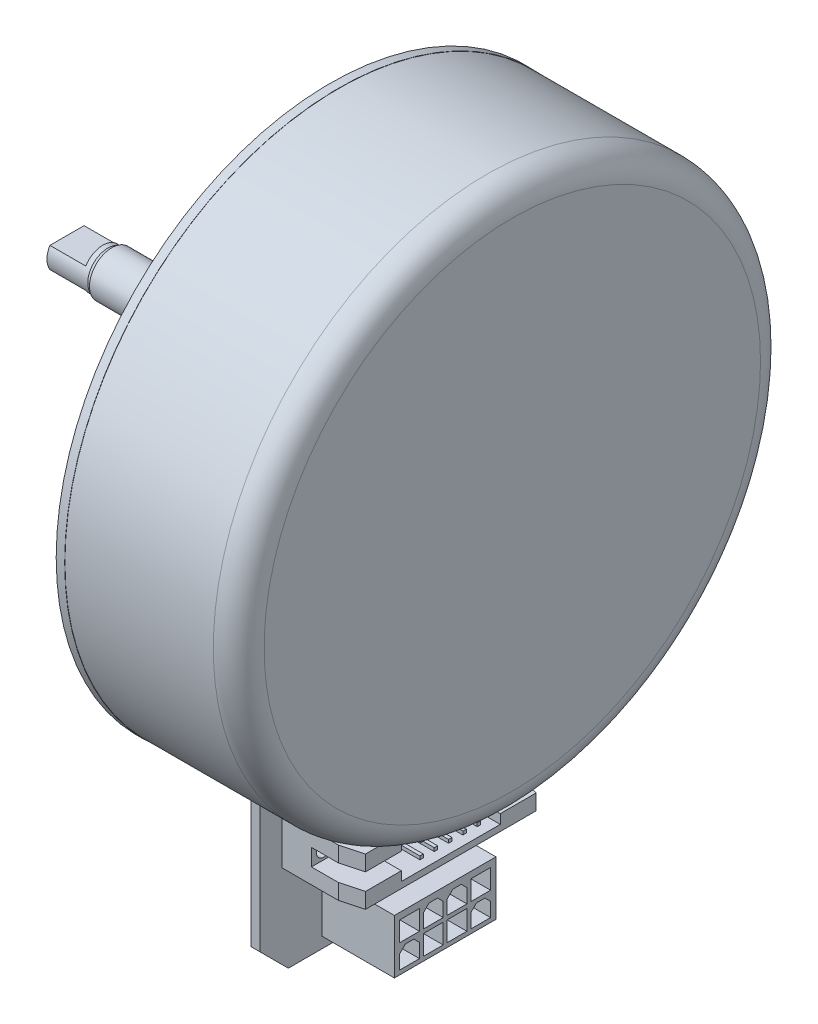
SolidWorks part; units mm, degrees
ref_plane "Front Plane" through (0, 0, 0) normal (0, 0, 1) x (1, 0, 0)
ref_plane "Top Plane" through (0, 0, 0) normal (0, 1, 0) x (1, 0, 0)
ref_plane "Right Plane" through (0, 0, 0) normal (1, 0, 0) x (0, 0, -1)
ref_plane "Plane1" through (7.6, 0, 0) normal (1, 0, 0) x (0, 0, -1)
sketch "Sketch1" plane through (7.6, 0, 0) normal (1, 0, 0) x (0, 0, -1)
  line L0 (-20, -44.1843) -> (20, -44.1843)
  arc A0 (20, -44.1843) -> (-20, -44.1843) centre (0, 0) ccw
extrude "Boss-Extrude1" add sketch "Sketch1" against normal blind 1.6
sketch "Sketch2" plane through (0, -44.1843, 0) normal (0, -1, 0) x (1, 0, 0)
  line L0 (7.6, 20) -> (7.6, -20)
  line L1 (7.6, -20) -> (6, -20)
  line L2 (6, -20) -> (6, 20)
  line L3 (6, 20) -> (7.6, 20)
extrude "Boss-Extrude2" add sketch "Sketch2" along normal blind 31.3157
sketch "Sketch3" plane through (7.6, 0, 0) normal (1, 0, 0) x (0, 0, -1)
  line L0 (-20, -51.5) -> (20, -51.5)
  line L1 (20, -51.5) -> (20, -75.5)
  line L2 (20, -75.5) -> (-20, -75.5)
  line L3 (-20, -75.5) -> (-20, -51.5)
extrude "Boss-Extrude3" add sketch "Sketch3" along normal blind 12.8
ref_plane "Plane2" through (0, 0, -1.7) normal (0, 0, -1) x (-1, 0, 0)
sketch "Sketch4" plane through (0, 0, -1.7) normal (0, 0, -1) x (-1, 0, 0)
  line L0 (-18.4, -75.5) -> (-20.4, -74.1)
  line L1 (-20.4, -74.1) -> (-20.4, -75.5)
  line L2 (-20.4, -75.5) -> (-18.4, -75.5)
extrude "Cut-Extrude1" cut sketch "Sketch4" against normal blind 3.4
sketch "Sketch5" plane through (0, -75.5, 0) normal (0, -1, 0) x (1, 0, 0)
  line L0 (20.4, 1.7) -> (20.4, 20)
  line L1 (20.4, 20) -> (6, 20)
  line L2 (6, 20) -> (6, -20)
  line L3 (6, -20) -> (20.4, -20)
  line L4 (20.4, -20) -> (20.4, -1.7)
  line L5 (20.4, -1.7) -> (17.4, -1.7)
  line L6 (17.4, -1.7) -> (17.4, 1.7)
  line L7 (17.4, 1.7) -> (20.4, 1.7)
extrude "Cut-Extrude2" cut sketch "Sketch5" against normal blind 1.4
sketch "Sketch6" plane through (20.4, 0, 0) normal (1, 0, 0) x (0, 0, -1)
  line L0 (-20, -51.5) -> (20, -51.5)
  line L1 (20, -51.5) -> (20, -74.1)
  line L2 (20, -74.1) -> (-20, -74.1)
  line L3 (-20, -74.1) -> (-20, -51.5)
extrude "Boss-Extrude4" add sketch "Sketch6" along normal blind 1
sketch "Sketch7" plane through (7.6, 0, 0) normal (1, 0, 0) x (0, 0, -1)
  circle A0 centre (0, 0) radius 48.5
extrude "Boss-Extrude5" add sketch "Sketch7" along normal blind 24.7
sketch "Sketch8" plane through (6, 0, 0) normal (-1, 0, 0) x (0, 0, 1)
  line L0 (-20.1, -42.4852) -> (-20.1, -44.1389)
  line L1 (20.1, -44.1389) -> (20.1, -42.4852)
  arc A0 (20.1, -42.4852) -> (-20.1, -42.4852) centre (0, 0) cw
  arc A1 (-20.1, -44.1389) -> (20.1, -44.1389) centre (0, 0) cw
extrude "Boss-Extrude6" add sketch "Sketch8" along normal blind 4.5
sketch "Sketch9" plane through (6, 0, 0) normal (-1, 0, 0) x (0, 0, 1)
  line L0 (-20, -44.1843) -> (-20, -42.5323)
  line L1 (-20.1, -42.4852) -> (-20.1, -44.1389)
  arc A0 (-20.1, -44.1389) -> (-20, -44.1843) centre (0, 0) ccw
  arc A1 (-20, -42.5323) -> (-20.1, -42.4852) centre (0, 0) cw
extrude "Cut-Extrude3" cut sketch "Sketch9" against normal blind 1.6
sketch "Sketch10" plane through (6, 0, 0) normal (-1, 0, 0) x (0, 0, 1)
  line L0 (20, -42.5323) -> (20, -44.1843)
  line L1 (20.1, -44.1389) -> (20.1, -42.4852)
  arc A0 (20, -44.1843) -> (20.1, -44.1389) centre (0, 0) ccw
  arc A1 (20.1, -42.4852) -> (20, -42.5323) centre (0, 0) cw
extrude "Cut-Extrude4" cut sketch "Sketch10" against normal blind 1.6
sketch "Sketch11" plane through (7.6, 0, 0) normal (-1, 0, 0) x (0, 0, 1)
  line L0 (20.1, -44.1389) -> (20.1, -42.4852)
  line L1 (-20.1, -42.4852) -> (-20.1, -44.1389)
  arc A0 (20.1, -42.4852) -> (-20.1, -42.4852) centre (0, 0) cw
  arc A1 (-20.1, -44.1389) -> (20.1, -44.1389) centre (0, 0) ccw
extrude "Cut-Extrude5" cut sketch "Sketch11" against normal blind 0.7
sketch "Sketch12" plane through (0, -51.5, 0) normal (0, 1, 0) x (-1, 0, 0)
  line L0 (-7.6, 3.135) -> (-7.6, 4.485)
  line L1 (-7.6, 4.485) -> (-16.525, 4.485)
  line L2 (-16.525, 3.135) -> (-7.6, 3.135)
  arc A0 (-16.525, 4.485) -> (-16.525, 3.135) centre (-16.525, 3.81) ccw
extrude "Cut-Extrude6" cut sketch "Sketch12" against normal blind 1.1
ref_plane "Plane3" through (0, -52.6, 0) normal (0, 1, 0) x (1, 0, 0)
sketch "Sketch13" plane through (0, -52.6, 0) normal (0, 1, 0) x (1, 0, 0)
  line L0 (15, 8.765) -> (15, -4.485)
  line L1 (15, -4.485) -> (21.4, -4.485)
  line L2 (21.4, -4.485) -> (21.4, 8.765)
  line L3 (21.4, 8.765) -> (15, 8.765)
extrude "Cut-Extrude7" cut sketch "Sketch13" against normal blind 0.9
sketch "Sketch14" plane through (0, 0, 4.485) normal (0, 0, -1) x (-1, 0, 0)
  line L0 (-21.4, -52.6) -> (-21.4, -53.5)
  line L1 (-21.4, -53.5) -> (-15, -53.5)
  line L2 (-15, -53.5) -> (-15, -52.6)
  line L3 (-15, -52.6) -> (-21.4, -52.6)
extrude "Cut-Extrude8" cut sketch "Sketch14" against normal blind 4.28
sketch "Sketch15" plane through (0, 0, 4.485) normal (0, 0, -1) x (-1, 0, 0)
  line L0 (-12.6, -51.5) -> (-12.6, -52.6)
  line L1 (-12.6, -52.6) -> (-7.6, -52.6)
  line L2 (-7.6, -52.6) -> (-7.6, -51.5)
  line L3 (-7.6, -51.5) -> (-12.6, -51.5)
extrude "Cut-Extrude9" cut sketch "Sketch15" against normal blind 2.515
sketch "Sketch16" plane through (0, 0, 3.135) normal (0, 0, 1) x (1, 0, 0)
  line L0 (7.6, -52.6) -> (12.6, -52.6)
  line L1 (12.6, -52.6) -> (12.6, -51.5)
  line L2 (12.6, -51.5) -> (7.6, -51.5)
  line L3 (7.6, -51.5) -> (7.6, -52.6)
extrude "Cut-Extrude10" cut sketch "Sketch16" against normal blind 10.135
sketch "Sketch17" plane through (0, 0, 3.135) normal (0, 0, 1) x (1, 0, 0)
  line L0 (14.2, -52.6) -> (14.2, -51.5)
  line L1 (14.2, -51.5) -> (12.6, -51.5)
  line L2 (12.6, -51.5) -> (12.6, -52.6)
  line L3 (12.6, -52.6) -> (14.2, -52.6)
extrude "Cut-Extrude11" cut sketch "Sketch17" against normal blind 1.085
sketch "Sketch18" plane through (0, 0, 2.05) normal (0, 0, 1) x (1, 0, 0)
  line L0 (21.4, -51.5) -> (12.6, -51.5)
  line L1 (12.6, -51.5) -> (12.6, -52.6)
  line L2 (12.6, -52.6) -> (14, -52.6)
  line L3 (14, -52.6) -> (14, -53.5)
  line L4 (14, -53.5) -> (15, -53.5)
  line L5 (15, -53.5) -> (15, -52.6)
  line L6 (15, -52.6) -> (21.4, -52.6)
  line L7 (21.4, -52.6) -> (21.4, -51.5)
extrude "Cut-Extrude12" cut sketch "Sketch18" against normal blind 0.24
sketch "Sketch19" plane through (0, 0, 1.81) normal (0, 0, 1) x (1, 0, 0)
  line L0 (14, -51.5) -> (14, -53.5)
  line L1 (14, -53.5) -> (15, -53.5)
  line L2 (15, -53.5) -> (15, -52.6)
  line L3 (15, -52.6) -> (21.4, -52.6)
  line L4 (21.4, -52.6) -> (21.4, -51.5)
  line L5 (21.4, -51.5) -> (14, -51.5)
extrude "Cut-Extrude13" cut sketch "Sketch19" against normal blind 3.86
sketch "Sketch20" plane through (0, -53.5, 0) normal (0, 1, 0) x (-1, 0, 0)
  line L0 (-21.4, 8.765) -> (-21.4, -8.765)
  line L1 (-21.4, -8.765) -> (-15, -8.765)
  line L2 (-15, -8.765) -> (-15, 8.765)
  line L3 (-15, 8.765) -> (-21.4, 8.765)
extrude "Cut-Extrude14" cut sketch "Sketch20" against normal blind 0.75
sketch "Sketch21" plane through (0, -54.25, 0) normal (0, 1, 0) x (-1, 0, 0)
  line L0 (-15, -6.45) -> (-15, 8.765)
  line L1 (-15, 8.765) -> (-21.4, 8.765)
  line L2 (-21.4, 8.765) -> (-21.4, -20)
  line L3 (-21.4, -20) -> (-12.85, -20)
  line L4 (-12.85, -20) -> (-12.85, -6.45)
  line L5 (-12.85, -6.45) -> (-15, -6.45)
extrude "Cut-Extrude15" cut sketch "Sketch21" against normal blind 3
ref_plane "Plane4" through (0, -57.25, 0) normal (0, -1, 0) x (1, 0, 0)
sketch "Sketch22" plane through (0, -57.25, 0) normal (0, -1, 0) x (1, 0, 0)
  line L0 (12.85, 13.7429) -> (12.85, 6.45)
  line L1 (12.85, 6.45) -> (15, 6.45)
  line L2 (15, 6.45) -> (15, 8.765)
  line L3 (15, 8.765) -> (21.4, 8.765)
  line L4 (21.4, 8.765) -> (21.4, 20)
  line L5 (21.4, 20) -> (12.85, 20)
  line L6 (12.85, 16.15) -> (12.85, 14.1972)
  spline S0 degree 3 poles (12.85, 20) (12.85, 18.7167) (12.85, 17.4333) (12.85, 16.15) knots 0 0 0 0 1 1 1 1
  spline S1 degree 3 poles (12.85, 14.1972) (12.85, 14.0457) (12.85, 13.8943) (12.85, 13.7429) knots 0 0 0 0 1 1 1 1
extrude "Cut-Extrude16" cut sketch "Sketch22" against normal blind 3
sketch "Sketch23" plane through (0, -52.6, 0) normal (0, 1, 0) x (-1, 0, 0)
  line L0 (-12.6, -7) -> (-7.6, -7)
  line L1 (-7.6, -7) -> (-7.6, 7)
  line L2 (-7.6, 7) -> (-12.6, 7)
  line L3 (-12.6, 7) -> (-12.6, -7)
extrude "Cut-Extrude17" cut sketch "Sketch23" against normal blind 0.1
sketch "Sketch24" plane through (0, -51.5, 0) normal (0, 1, 0) x (-1, 0, 0)
  line L0 (-11.9551, 8.32) -> (-7.6, 8.32)
  line L1 (-7.6, 8.32) -> (-7.6, 13.52)
  line L2 (-7.6, 13.52) -> (-11.9551, 13.52)
  line L3 (-11.9551, 13.52) -> (-13.4562, 10.92)
  line L4 (-13.4562, 10.92) -> (-11.9551, 8.32)
extrude "Cut-Extrude18" cut sketch "Sketch24" against normal blind 1.7
sketch "Sketch25" plane through (0, -51.5, 0) normal (0, 1, 0) x (-1, 0, 0)
  line L0 (-11.9551, -13.52) -> (-7.6, -13.52)
  line L1 (-7.6, -13.52) -> (-7.6, -8.32)
  line L2 (-7.6, -8.32) -> (-11.9551, -8.32)
  line L3 (-11.9551, -8.32) -> (-13.4562, -10.92)
  line L4 (-13.4562, -10.92) -> (-11.9551, -13.52)
extrude "Cut-Extrude19" cut sketch "Sketch25" against normal blind 1.7
sketch "Sketch26" plane through (0, 0, -20) normal (0, 0, -1) x (-1, 0, 0)
  line L0 (-7.6, -51.5) -> (-21.4, -51.5)
  line L1 (-21.4, -51.5) -> (-21.4, -54.25)
  line L2 (-21.4, -54.25) -> (-12.85, -54.25)
  line L3 (-12.85, -54.25) -> (-12.85, -57.25)
  line L4 (-12.85, -57.25) -> (-21.4, -57.25)
  line L5 (-21.4, -57.25) -> (-21.4, -74.1)
  line L6 (-21.4, -74.1) -> (-7.6, -74.1)
  line L7 (-7.6, -74.1) -> (-7.6, -51.5)
extrude "Cut-Extrude20" cut sketch "Sketch26" against normal blind 3.85
sketch "Sketch27" plane through (0, -51.5, 0) normal (0, 1, 0) x (-1, 0, 0)
  line L0 (-21.4, 5.81) -> (-21.4, 2.05)
  line L1 (-21.4, 2.05) -> (-14.2, 2.05)
  line L2 (-14.2, 2.05) -> (-14.2, 3.135)
  line L3 (-14.2, 3.135) -> (-16.525, 3.135)
  line L4 (-16.525, 4.485) -> (-14.2, 4.485)
  line L5 (-12.6, 4.485) -> (-12.6, 5.81)
  line L6 (-12.6, 5.81) -> (-21.4, 5.81)
  arc A0 (-16.525, 3.135) -> (-16.525, 4.485) centre (-16.525, 3.81) cw
  spline S0 degree 3 poles (-12.6, 4.485) (-13.1333, 4.485) (-13.6667, 4.485) (-14.2, 4.485) knots 0 0 0 0 1 1 1 1
extrude "Cut-Extrude21" cut sketch "Sketch27" against normal blind 0.4
sketch "Sketch28" plane through (0, 0, 20) normal (0, 0, 1) x (1, 0, 0)
  line L0 (12.85, -54.25) -> (21.4, -54.25)
  line L1 (21.4, -54.25) -> (21.4, -51.5)
  line L2 (21.4, -51.5) -> (7.6, -51.5)
  line L3 (7.6, -51.5) -> (7.6, -74.1)
  line L4 (7.6, -74.1) -> (21.4, -74.1)
  line L5 (21.4, -74.1) -> (21.4, -57.25)
  line L6 (21.4, -57.25) -> (12.85, -57.25)
  line L7 (12.85, -57.25) -> (12.85, -54.25)
extrude "Cut-Extrude22" cut sketch "Sketch28" against normal blind 3.85
sketch "Sketch29" plane through (0, -74.1, 0) normal (0, -1, 0) x (1, 0, 0)
  line L0 (7.6, 9) -> (20.4, 9)
  line L1 (20.4, 9) -> (20.4, -9)
  line L2 (20.4, -9) -> (7.6, -9)
  line L3 (7.6, -9) -> (7.6, -16.15)
  line L4 (7.6, -16.15) -> (21.4, -16.15)
  line L5 (21.4, -16.15) -> (21.4, 16.15)
  line L6 (21.4, 16.15) -> (7.6, 16.15)
  line L7 (7.6, 16.15) -> (7.6, 9)
extrude "Cut-Extrude23" cut sketch "Sketch29" against normal blind 9.6
ref_plane "Plane5" through (0, -58.52, 0) normal (0, 1, 0) x (1, 0, 0)
sketch "Sketch30" plane through (0, -58.52, 0) normal (0, 1, 0) x (1, 0, 0)
  line L0 (7.6, -7.5) -> (12.7, -7.5)
  line L1 (12.7, -7.5) -> (12.7, 7.5)
  line L2 (12.7, 7.5) -> (7.6, 7.5)
  line L3 (7.6, 7.5) -> (7.6, -7.5)
extrude "Cut-Extrude24" cut sketch "Sketch30" against normal blind 5.98
sketch "Sketch31" plane through (0, -64.5, 0) normal (0, -1, 0) x (1, 0, 0)
  line L0 (7.6, 16.15) -> (7.6, 7.5)
  line L1 (7.6, 7.5) -> (12.7, 7.5)
  line L2 (12.7, 7.5) -> (12.7, -7.5)
  line L3 (12.7, -7.5) -> (7.6, -7.5)
  line L4 (7.6, -7.5) -> (7.6, -16.15)
  line L5 (7.6, -16.15) -> (21.4, -16.15)
  line L6 (21.4, -16.15) -> (21.4, 16.15)
  line L7 (21.4, 16.15) -> (7.6, 16.15)
extrude "Cut-Extrude25" cut sketch "Sketch31" against normal blind 4.5
sketch "Sketch32" plane through (0, -74.1, 0) normal (0, -1, 0) x (1, 0, 0)
  line L0 (6, -20) -> (6, 20)
  line L1 (6, 20) -> (7.6, 20)
  line L2 (7.6, 20) -> (7.6, -20)
  line L3 (7.6, -20) -> (6, -20)
extrude "Boss-Extrude7" add sketch "Sketch32" along normal blind 1.9
ref_plane "Plane6" through (1.5, 0, 0) normal (1, 0, 0) x (0, 0, -1)
sketch "Sketch33" plane through (1.5, 0, 0) normal (1, 0, 0) x (0, 0, -1)
  circle A0 centre (0, 0) radius 48.55
extrude "Boss-Extrude8" add sketch "Sketch33" against normal blind 1.5
sketch "Sketch34" plane through (0, -54.25, 0) normal (0, -1, 0) x (1, 0, 0)
  line L0 (12.85, -12.95) -> (12.85, -6.45)
  line L1 (12.85, -6.45) -> (13.6, -6.45)
  line L2 (13.6, -6.45) -> (13.6, -12.95)
  line L3 (13.6, -12.95) -> (12.85, -12.95)
extrude "Boss-Extrude9" add sketch "Sketch34" along normal blind 3
sketch "Sketch35" plane through (13.6, 0, 0) normal (1, 0, 0) x (0, 0, -1)
  line L0 (6.45, -54.25) -> (6.45, -57.25)
  line L1 (6.45, -57.25) -> (9.65, -57.25)
  line L2 (9.65, -57.25) -> (9.65, -54.25)
  line L3 (9.65, -54.25) -> (6.45, -54.25)
extrude "Cut-Extrude26" cut sketch "Sketch35" against normal blind 1.25
sketch "Sketch36" plane through (0, -57.25, 0) normal (0, 1, 0) x (-1, 0, 0)
  line L0 (-13.6, 12.95) -> (-12.85, 12.95)
  line L1 (-12.85, 12.95) -> (-12.85, 6.45)
  line L2 (-12.85, 6.45) -> (-13.6, 6.45)
  line L3 (-13.6, 6.45) -> (-13.6, 12.95)
extrude "Boss-Extrude10" add sketch "Sketch36" along normal blind 3
sketch "Sketch37" plane through (13.6, 0, 0) normal (1, 0, 0) x (0, 0, -1)
  line L0 (-6.45, -54.25) -> (-11.75, -54.25)
  line L1 (-11.75, -54.25) -> (-11.75, -57.25)
  line L2 (-11.75, -57.25) -> (-6.45, -57.25)
  line L3 (-6.45, -57.25) -> (-6.45, -54.25)
extrude "Cut-Extrude27" cut sketch "Sketch37" against normal blind 1.25
sketch "Sketch38" plane through (12.6, 0, 0) normal (-1, 0, 0) x (0, 0, 1)
  line L0 (5.81, -52.6) -> (5.81, -51.9)
  line L1 (5.81, -51.9) -> (4.485, -51.9)
  line L2 (4.485, -51.9) -> (4.485, -52.6)
  line L3 (4.485, -52.6) -> (5.81, -52.6)
extrude "Cut-Extrude28" cut sketch "Sketch38" against normal blind 1.6
sketch "Sketch39" plane through (0, -57.25, 0) normal (0, 1, 0) x (-1, 0, 0)
  line L0 (-15, -8.765) -> (-15, 8.765)
  line L1 (-15, 8.765) -> (-21.4, 8.765)
  line L2 (-21.4, 8.765) -> (-21.4, -8.765)
  line L3 (-21.4, -8.765) -> (-15, -8.765)
extrude "Cut-Extrude29" cut sketch "Sketch39" against normal blind 1.65
sketch "Sketch40" plane through (0, -51.9, 0) normal (0, 1, 0) x (-1, 0, 0)
  line L0 (-21.4, 2.81) -> (-20.4, 2.81)
  line L1 (-20.4, 2.81) -> (-20.4, 4.81)
  line L2 (-20.4, 4.81) -> (-21.4, 4.81)
  line L3 (-21.4, 4.81) -> (-21.4, 2.81)
extrude "Cut-Extrude30" cut sketch "Sketch40" against normal up to next
sketch "Sketch41" plane through (20.4, 0, 0) normal (1, 0, 0) x (0, 0, -1)
  line L0 (-8.05, -69.15) -> (-4.55, -69.15)
  line L1 (-4.55, -69.15) -> (-4.55, -65.65)
  line L2 (-4.55, -65.65) -> (-8.05, -65.65)
  line L3 (-8.05, -65.65) -> (-8.05, -69.15)
extrude "Cut-Extrude31" cut sketch "Sketch41" against normal blind 12.8
sketch "Sketch42" plane through (7.6, 0, 0) normal (1, 0, 0) x (0, 0, -1)
  line L0 (-5.8151, -67.9698) -> (-6.7849, -67.9698)
  line L1 (-6.7849, -67.9698) -> (-6.7849, -67)
  line L2 (-6.7849, -67) -> (-5.8151, -67)
  line L3 (-5.8151, -67) -> (-5.8151, -67.9698)
extrude "Boss-Extrude11" add sketch "Sketch42" along normal blind 3
sketch "Sketch43" plane through (20.4, 0, 0) normal (1, 0, 0) x (0, 0, -1)
  line L0 (4.55, -69.15) -> (8.05, -69.15)
  line L1 (8.05, -69.15) -> (8.05, -65.65)
  line L2 (8.05, -65.65) -> (4.55, -65.65)
  line L3 (4.55, -65.65) -> (4.55, -69.15)
extrude "Cut-Extrude32" cut sketch "Sketch43" against normal blind 12.8
sketch "Sketch44" plane through (7.6, 0, 0) normal (1, 0, 0) x (0, 0, -1)
  line L0 (6.7849, -67.9698) -> (5.8151, -67.9698)
  line L1 (5.8151, -67.9698) -> (5.8151, -67)
  line L2 (5.8151, -67) -> (6.7849, -67)
  line L3 (6.7849, -67) -> (6.7849, -67.9698)
extrude "Boss-Extrude12" add sketch "Sketch44" along normal blind 3
sketch "Sketch45" plane through (20.4, 0, 0) normal (1, 0, 0) x (0, 0, -1)
  line L0 (-3.85, -73.35) -> (-0.35, -73.35)
  line L1 (-0.35, -73.35) -> (-0.35, -69.85)
  line L2 (-0.35, -69.85) -> (-3.85, -69.85)
  line L3 (-3.85, -69.85) -> (-3.85, -73.35)
extrude "Cut-Extrude33" cut sketch "Sketch45" against normal blind 12.8
sketch "Sketch46" plane through (7.6, 0, 0) normal (1, 0, 0) x (0, 0, -1)
  line L0 (-1.6151, -72.1698) -> (-2.5849, -72.1698)
  line L1 (-2.5849, -72.1698) -> (-2.5849, -71.2)
  line L2 (-2.5849, -71.2) -> (-1.6151, -71.2)
  line L3 (-1.6151, -71.2) -> (-1.6151, -72.1698)
extrude "Boss-Extrude13" add sketch "Sketch46" along normal blind 3
sketch "Sketch47" plane through (20.4, 0, 0) normal (1, 0, 0) x (0, 0, -1)
  line L0 (0.35, -73.35) -> (3.85, -73.35)
  line L1 (3.85, -73.35) -> (3.85, -69.85)
  line L2 (3.85, -69.85) -> (0.35, -69.85)
  line L3 (0.35, -69.85) -> (0.35, -73.35)
extrude "Cut-Extrude34" cut sketch "Sketch47" against normal blind 12.8
sketch "Sketch48" plane through (7.6, 0, 0) normal (1, 0, 0) x (0, 0, -1)
  line L0 (2.5849, -72.1698) -> (1.6151, -72.1698)
  line L1 (1.6151, -72.1698) -> (1.6151, -71.2)
  line L2 (1.6151, -71.2) -> (2.5849, -71.2)
  line L3 (2.5849, -71.2) -> (2.5849, -72.1698)
extrude "Boss-Extrude14" add sketch "Sketch48" along normal blind 3
sketch "Sketch49" plane through (20.4, 0, 0) normal (1, 0, 0) x (0, 0, -1)
  line L0 (0.35, -65.65) -> (0.35, -69.15)
  line L1 (0.35, -69.15) -> (3.85, -69.15)
  line L2 (3.85, -69.15) -> (3.85, -65.65)
  line L3 (3.85, -65.65) -> (0.35, -65.65)
extrude "Cut-Extrude35" cut sketch "Sketch49" against normal blind 12.8
sketch "Sketch50" plane through (7.6, 0, 0) normal (1, 0, 0) x (0, 0, -1)
  line L0 (2.5849, -67.9698) -> (1.6151, -67.9698)
  line L1 (1.6151, -67.9698) -> (1.6151, -67)
  line L2 (1.6151, -67) -> (2.5849, -67)
  line L3 (2.5849, -67) -> (2.5849, -67.9698)
extrude "Boss-Extrude15" add sketch "Sketch50" along normal blind 3
sketch "Sketch51" plane through (20.4, 0, 0) normal (1, 0, 0) x (0, 0, -1)
  line L0 (-3.85, -65.65) -> (-3.85, -69.15)
  line L1 (-3.85, -69.15) -> (-0.35, -69.15)
  line L2 (-0.35, -69.15) -> (-0.35, -65.65)
  line L3 (-0.35, -65.65) -> (-3.85, -65.65)
extrude "Cut-Extrude36" cut sketch "Sketch51" against normal blind 12.8
sketch "Sketch52" plane through (7.6, 0, 0) normal (1, 0, 0) x (0, 0, -1)
  line L0 (-1.6151, -67.9698) -> (-2.5849, -67.9698)
  line L1 (-2.5849, -67.9698) -> (-2.5849, -67)
  line L2 (-2.5849, -67) -> (-1.6151, -67)
  line L3 (-1.6151, -67) -> (-1.6151, -67.9698)
extrude "Boss-Extrude16" add sketch "Sketch52" along normal blind 3
sketch "Sketch53" plane through (20.4, 0, 0) normal (1, 0, 0) x (0, 0, -1)
  line L0 (-8.05, -73.35) -> (-4.55, -73.35)
  line L1 (-4.55, -73.35) -> (-4.55, -69.85)
  line L2 (-4.55, -69.85) -> (-8.05, -69.85)
  line L3 (-8.05, -69.85) -> (-8.05, -73.35)
extrude "Cut-Extrude37" cut sketch "Sketch53" against normal blind 12.8
sketch "Sketch54" plane through (7.6, 0, 0) normal (1, 0, 0) x (0, 0, -1)
  line L0 (-5.8151, -72.1698) -> (-6.7849, -72.1698)
  line L1 (-6.7849, -72.1698) -> (-6.7849, -71.2)
  line L2 (-6.7849, -71.2) -> (-5.8151, -71.2)
  line L3 (-5.8151, -71.2) -> (-5.8151, -72.1698)
extrude "Boss-Extrude17" add sketch "Sketch54" along normal blind 3
sketch "Sketch55" plane through (20.4, 0, 0) normal (1, 0, 0) x (0, 0, -1)
  line L0 (4.55, -73.35) -> (8.05, -73.35)
  line L1 (8.05, -73.35) -> (8.05, -69.85)
  line L2 (8.05, -69.85) -> (4.55, -69.85)
  line L3 (4.55, -69.85) -> (4.55, -73.35)
extrude "Cut-Extrude38" cut sketch "Sketch55" against normal blind 12.8
sketch "Sketch56" plane through (7.6, 0, 0) normal (1, 0, 0) x (0, 0, -1)
  line L0 (6.7849, -72.1698) -> (5.8151, -72.1698)
  line L1 (5.8151, -72.1698) -> (5.8151, -71.2)
  line L2 (5.8151, -71.2) -> (6.7849, -71.2)
  line L3 (6.7849, -71.2) -> (6.7849, -72.1698)
extrude "Boss-Extrude18" add sketch "Sketch56" along normal blind 3
sketch "Sketch57" plane through (15, 0, 0) normal (1, 0, 0) x (0, 0, -1)
  line L0 (-2.84, -54.18) -> (-2.24, -54.18)
  line L1 (-2.24, -54.18) -> (-2.24, -54.78)
  line L2 (-2.24, -54.78) -> (-2.84, -54.78)
  line L3 (-2.84, -54.78) -> (-2.84, -54.18)
extrude "Boss-Extrude19" add sketch "Sketch57" along normal blind 6.3
sketch "Sketch58" plane through (15, 0, 0) normal (1, 0, 0) x (0, 0, -1)
  line L0 (-2.84, -56.72) -> (-2.24, -56.72)
  line L1 (-2.24, -56.72) -> (-2.24, -57.32)
  line L2 (-2.24, -57.32) -> (-2.84, -57.32)
  line L3 (-2.84, -57.32) -> (-2.84, -56.72)
extrude "Boss-Extrude20" add sketch "Sketch58" along normal blind 6.3
sketch "Sketch59" plane through (15, 0, 0) normal (1, 0, 0) x (0, 0, -1)
  line L0 (-0.3, -54.18) -> (0.3, -54.18)
  line L1 (0.3, -54.18) -> (0.3, -54.78)
  line L2 (0.3, -54.78) -> (-0.3, -54.78)
  line L3 (-0.3, -54.78) -> (-0.3, -54.18)
extrude "Boss-Extrude21" add sketch "Sketch59" along normal blind 6.3
sketch "Sketch60" plane through (15, 0, 0) normal (1, 0, 0) x (0, 0, -1)
  line L0 (-0.3, -56.72) -> (0.3, -56.72)
  line L1 (0.3, -56.72) -> (0.3, -57.32)
  line L2 (0.3, -57.32) -> (-0.3, -57.32)
  line L3 (-0.3, -57.32) -> (-0.3, -56.72)
extrude "Boss-Extrude22" add sketch "Sketch60" along normal blind 6.3
sketch "Sketch61" plane through (15, 0, 0) normal (1, 0, 0) x (0, 0, -1)
  line L0 (2.24, -56.72) -> (2.84, -56.72)
  line L1 (2.84, -56.72) -> (2.84, -57.32)
  line L2 (2.84, -57.32) -> (2.24, -57.32)
  line L3 (2.24, -57.32) -> (2.24, -56.72)
extrude "Boss-Extrude23" add sketch "Sketch61" along normal blind 6.3
sketch "Sketch62" plane through (15, 0, 0) normal (1, 0, 0) x (0, 0, -1)
  line L0 (2.24, -54.18) -> (2.84, -54.18)
  line L1 (2.84, -54.18) -> (2.84, -54.78)
  line L2 (2.84, -54.78) -> (2.24, -54.78)
  line L3 (2.24, -54.78) -> (2.24, -54.18)
extrude "Boss-Extrude24" add sketch "Sketch62" along normal blind 6.3
sketch "Sketch63" plane through (15, 0, 0) normal (1, 0, 0) x (0, 0, -1)
  line L0 (4.78, -57.32) -> (4.78, -56.72)
  line L1 (4.78, -56.72) -> (5.38, -56.72)
  line L2 (5.38, -56.72) -> (5.38, -57.32)
  line L3 (5.38, -57.32) -> (4.78, -57.32)
extrude "Boss-Extrude25" add sketch "Sketch63" along normal blind 6.3
sketch "Sketch64" plane through (15, 0, 0) normal (1, 0, 0) x (0, 0, -1)
  line L0 (-5.38, -57.32) -> (-5.38, -56.72)
  line L1 (-5.38, -56.72) -> (-4.78, -56.72)
  line L2 (-4.78, -56.72) -> (-4.78, -57.32)
  line L3 (-4.78, -57.32) -> (-5.38, -57.32)
extrude "Boss-Extrude26" add sketch "Sketch64" along normal blind 6.3
sketch "Sketch65" plane through (15, 0, 0) normal (1, 0, 0) x (0, 0, -1)
  line L0 (4.78, -54.78) -> (4.78, -54.18)
  line L1 (4.78, -54.18) -> (5.38, -54.18)
  line L2 (5.38, -54.18) -> (5.38, -54.78)
  line L3 (5.38, -54.78) -> (4.78, -54.78)
extrude "Boss-Extrude27" add sketch "Sketch65" along normal blind 6.3
sketch "Sketch66" plane through (15, 0, 0) normal (1, 0, 0) x (0, 0, -1)
  line L0 (-5.38, -54.78) -> (-5.38, -54.18)
  line L1 (-5.38, -54.18) -> (-4.78, -54.18)
  line L2 (-4.78, -54.18) -> (-4.78, -54.78)
  line L3 (-4.78, -54.78) -> (-5.38, -54.78)
extrude "Boss-Extrude28" add sketch "Sketch66" along normal blind 6.3
sketch "Sketch67" plane through (6, 0, 0) normal (-1, 0, 0) x (0, 0, 1)
  line L0 (-4.78, -54.18) -> (-4.78, -54.78)
  line L1 (-4.78, -54.78) -> (-5.38, -54.78)
  line L2 (-5.38, -54.78) -> (-5.38, -54.18)
  line L3 (-5.38, -54.18) -> (-4.78, -54.18)
extrude "Boss-Extrude29" add sketch "Sketch67" along normal blind 1.6
sketch "Sketch68" plane through (6, 0, 0) normal (-1, 0, 0) x (0, 0, 1)
  line L0 (-2.84, -54.78) -> (-2.84, -54.18)
  line L1 (-2.84, -54.18) -> (-2.24, -54.18)
  line L2 (-2.24, -54.18) -> (-2.24, -54.78)
  line L3 (-2.24, -54.78) -> (-2.84, -54.78)
extrude "Boss-Extrude30" add sketch "Sketch68" along normal blind 1.6
sketch "Sketch69" plane through (6, 0, 0) normal (-1, 0, 0) x (0, 0, 1)
  line L0 (-0.3, -54.78) -> (-0.3, -54.18)
  line L1 (-0.3, -54.18) -> (0.3, -54.18)
  line L2 (0.3, -54.18) -> (0.3, -54.78)
  line L3 (0.3, -54.78) -> (-0.3, -54.78)
extrude "Boss-Extrude31" add sketch "Sketch69" along normal blind 1.6
sketch "Sketch70" plane through (6, 0, 0) normal (-1, 0, 0) x (0, 0, 1)
  line L0 (2.24, -54.78) -> (2.24, -54.18)
  line L1 (2.24, -54.18) -> (2.84, -54.18)
  line L2 (2.84, -54.18) -> (2.84, -54.78)
  line L3 (2.84, -54.78) -> (2.24, -54.78)
extrude "Boss-Extrude32" add sketch "Sketch70" along normal blind 1.6
sketch "Sketch71" plane through (6, 0, 0) normal (-1, 0, 0) x (0, 0, 1)
  line L0 (4.78, -54.18) -> (5.38, -54.18)
  line L1 (5.38, -54.18) -> (5.38, -54.78)
  line L2 (5.38, -54.78) -> (4.78, -54.78)
  line L3 (4.78, -54.78) -> (4.78, -54.18)
extrude "Boss-Extrude33" add sketch "Sketch71" along normal blind 1.6
sketch "Sketch72" plane through (6, 0, 0) normal (-1, 0, 0) x (0, 0, 1)
  line L0 (4.78, -56.72) -> (5.38, -56.72)
  line L1 (5.38, -56.72) -> (5.38, -57.32)
  line L2 (5.38, -57.32) -> (4.78, -57.32)
  line L3 (4.78, -57.32) -> (4.78, -56.72)
extrude "Boss-Extrude34" add sketch "Sketch72" along normal blind 1.6
sketch "Sketch73" plane through (6, 0, 0) normal (-1, 0, 0) x (0, 0, 1)
  line L0 (2.24, -57.32) -> (2.24, -56.72)
  line L1 (2.24, -56.72) -> (2.84, -56.72)
  line L2 (2.84, -56.72) -> (2.84, -57.32)
  line L3 (2.84, -57.32) -> (2.24, -57.32)
extrude "Boss-Extrude35" add sketch "Sketch73" along normal blind 1.6
sketch "Sketch74" plane through (6, 0, 0) normal (-1, 0, 0) x (0, 0, 1)
  line L0 (-0.3, -57.32) -> (-0.3, -56.72)
  line L1 (-0.3, -56.72) -> (0.3, -56.72)
  line L2 (0.3, -56.72) -> (0.3, -57.32)
  line L3 (0.3, -57.32) -> (-0.3, -57.32)
extrude "Boss-Extrude36" add sketch "Sketch74" along normal blind 1.6
sketch "Sketch75" plane through (6, 0, 0) normal (-1, 0, 0) x (0, 0, 1)
  line L0 (-2.84, -57.32) -> (-2.84, -56.72)
  line L1 (-2.84, -56.72) -> (-2.24, -56.72)
  line L2 (-2.24, -56.72) -> (-2.24, -57.32)
  line L3 (-2.24, -57.32) -> (-2.84, -57.32)
extrude "Boss-Extrude37" add sketch "Sketch75" along normal blind 1.6
sketch "Sketch76" plane through (6, 0, 0) normal (-1, 0, 0) x (0, 0, 1)
  line L0 (-4.78, -56.72) -> (-4.78, -57.32)
  line L1 (-4.78, -57.32) -> (-5.38, -57.32)
  line L2 (-5.38, -57.32) -> (-5.38, -56.72)
  line L3 (-5.38, -56.72) -> (-4.78, -56.72)
extrude "Boss-Extrude38" add sketch "Sketch76" along normal blind 1.6
sketch "Sketch77" plane through (6, 0, 0) normal (-1, 0, 0) x (0, 0, 1)
  line L0 (-5.8151, -71.2) -> (-5.8151, -72.1698)
  line L1 (-5.8151, -72.1698) -> (-6.7849, -72.1698)
  line L2 (-6.7849, -72.1698) -> (-6.7849, -71.2)
  line L3 (-6.7849, -71.2) -> (-5.8151, -71.2)
extrude "Boss-Extrude39" add sketch "Sketch77" along normal blind 1.4
sketch "Sketch78" plane through (6, 0, 0) normal (-1, 0, 0) x (0, 0, 1)
  line L0 (-1.6151, -71.2) -> (-1.6151, -72.1698)
  line L1 (-1.6151, -72.1698) -> (-2.5849, -72.1698)
  line L2 (-2.5849, -72.1698) -> (-2.5849, -71.2)
  line L3 (-2.5849, -71.2) -> (-1.6151, -71.2)
extrude "Boss-Extrude40" add sketch "Sketch78" along normal blind 1.4
sketch "Sketch79" plane through (6, 0, 0) normal (-1, 0, 0) x (0, 0, 1)
  line L0 (2.5849, -71.2) -> (2.5849, -72.1698)
  line L1 (2.5849, -72.1698) -> (1.6151, -72.1698)
  line L2 (1.6151, -72.1698) -> (1.6151, -71.2)
  line L3 (1.6151, -71.2) -> (2.5849, -71.2)
extrude "Boss-Extrude41" add sketch "Sketch79" along normal blind 1.4
sketch "Sketch80" plane through (6, 0, 0) normal (-1, 0, 0) x (0, 0, 1)
  line L0 (6.7849, -71.2) -> (6.7849, -72.1698)
  line L1 (6.7849, -72.1698) -> (5.8151, -72.1698)
  line L2 (5.8151, -72.1698) -> (5.8151, -71.2)
  line L3 (5.8151, -71.2) -> (6.7849, -71.2)
extrude "Boss-Extrude42" add sketch "Sketch80" along normal blind 1.4
sketch "Sketch81" plane through (6, 0, 0) normal (-1, 0, 0) x (0, 0, 1)
  line L0 (-5.8151, -67) -> (-5.8151, -67.9698)
  line L1 (-5.8151, -67.9698) -> (-6.7849, -67.9698)
  line L2 (-6.7849, -67.9698) -> (-6.7849, -67)
  line L3 (-6.7849, -67) -> (-5.8151, -67)
extrude "Boss-Extrude43" add sketch "Sketch81" along normal blind 1.4
sketch "Sketch82" plane through (6, 0, 0) normal (-1, 0, 0) x (0, 0, 1)
  line L0 (-1.6151, -67) -> (-1.6151, -67.9698)
  line L1 (-1.6151, -67.9698) -> (-2.5849, -67.9698)
  line L2 (-2.5849, -67.9698) -> (-2.5849, -67)
  line L3 (-2.5849, -67) -> (-1.6151, -67)
extrude "Boss-Extrude44" add sketch "Sketch82" along normal blind 1.4
sketch "Sketch83" plane through (6, 0, 0) normal (-1, 0, 0) x (0, 0, 1)
  line L0 (2.5849, -67) -> (2.5849, -67.9698)
  line L1 (2.5849, -67.9698) -> (1.6151, -67.9698)
  line L2 (1.6151, -67.9698) -> (1.6151, -67)
  line L3 (1.6151, -67) -> (2.5849, -67)
extrude "Boss-Extrude45" add sketch "Sketch83" along normal blind 1.4
sketch "Sketch84" plane through (6, 0, 0) normal (-1, 0, 0) x (0, 0, 1)
  line L0 (6.7849, -67) -> (6.7849, -67.9698)
  line L1 (6.7849, -67.9698) -> (5.8151, -67.9698)
  line L2 (5.8151, -67.9698) -> (5.8151, -67)
  line L3 (5.8151, -67) -> (6.7849, -67)
extrude "Boss-Extrude46" add sketch "Sketch84" along normal blind 1.4
sketch "Sketch85" plane through (0, -51.5, 0) normal (0, 1, 0) x (-1, 0, 0)
  line L0 (-18.6, -5.08) -> (-21.1, -3.83)
  line L1 (-21.1, -3.83) -> (-21.1, -6.33)
  line L2 (-21.1, -6.33) -> (-18.6, -5.08)
extrude "Cut-Extrude39" cut sketch "Sketch85" against normal blind 0.3
sketch "Sketch86" plane through (0, 0, 0) normal (-1, 0, 0) x (0, 0, 1)
  circle A0 centre (0, 0) radius 12.5
extrude "Boss-Extrude47" add sketch "Sketch86" along normal blind 3.2
hole_wizard "Ø16.0 (16) Diameter Hole1" positions "Sketch88" profile "Sketch87" hole size "Ø16.0" standard "ANSI Metric"
sketch "Sketch88" plane through (-3.2, 0, 0) normal (-1, 0, 0) x (0, 0, 1)
  point P0 (0, 0)
sketch "Sketch87" plane through (-3.2, 0, 0) normal (0, 1, 0) x (0, 0, 1)
  line L0 (0, 0) -> (0, 1)
  line L1 (0, 1) -> (8, 1)
  line L2 (8, 1) -> (8, 0)
  line L5 (8, 0) -> (0, 0)
  line L10 (0, 1) -> (-8, 1) construction
  line L11 (0, -6.35) -> (0, 107.95) construction
  dimension "Hole Dia." = 16
  dimension "Hole Depth" = 1
  dimension "Drill Angle" = 180
draft "Draft1" type of draft neutral plane draft angle 59.237 faces to draft 1 parameters "D1"=59.237
draft "Draft2" type of draft neutral plane draft angle 59.237 faces to draft 1 parameters "D1"=59.237
ref_plane "Plane7" through (0, 0, 0) normal (0, 0, -1) x (-1, 0, 0)
sketch "Sketch89" plane through (0, 0, 0) normal (0, 0, -1) x (-1, 0, 0)
  line L0 (2.7, 9.5) -> (2.7, 8)
  line L1 (2.7, 8) -> (3.2, 8)
  line L2 (3.2, 8) -> (3.2, 9.5)
  line L3 (3.2, 9.5) -> (2.7, 9.5)
  line L4 (2.7, 0) -> (3.2, 0) construction
revolve "Cut-Revolve1" cut sketch "Sketch89" angle 360 about L4
ref_plane "Plane8" through (0, -55.53, 0) normal (0, 1, 0) x (1, 0, 0)
sketch "Sketch90" plane through (0, -55.53, 0) normal (0, 1, 0) x (1, 0, 0)
  line L0 (7.6, -12.67) -> (7.6, -13.97)
  line L1 (7.6, -13.97) -> (12.85, -13.97)
  line L2 (12.85, -13.97) -> (12.85, -12.67)
  line L3 (12.85, -12.67) -> (7.6, -12.67)
  line L4 (7.6, -13.97) -> (12.85, -13.97) construction
revolve "Cut-Revolve2" cut sketch "Sketch90" angle 360 about L4
sketch "Sketch91" plane through (0, -55.53, 0) normal (0, 1, 0) x (1, 0, 0)
  line L0 (7.6, 15.27) -> (7.6, 13.97)
  line L1 (7.6, 13.97) -> (12.85, 13.97)
  line L2 (12.85, 13.97) -> (12.85, 15.27)
  line L3 (12.85, 15.27) -> (7.6, 15.27)
  line L4 (7.6, 13.97) -> (12.85, 13.97) construction
revolve "Cut-Revolve3" cut sketch "Sketch91" angle 360 about L4
sketch "Sketch92" plane through (0, 0, 0) normal (0, 0, -1) x (-1, 0, 0)
  line L0 (2.2, 6.5) -> (2.2, 0)
  line L1 (2.2, 0) -> (25.2, 0)
  line L2 (25.2, 0) -> (25.2, 5)
  line L3 (25.2, 5) -> (2.7, 5)
  line L4 (2.7, 5) -> (2.7, 6.5)
  line L5 (2.7, 6.5) -> (2.2, 6.5)
  line L6 (2.2, 0) -> (25.2, 0) construction
revolve "Revolve1" [suppressed] add sketch "Sketch92" angle 360 about L6
hole_wizard "Ø2.5 (2.5) Diameter Hole1" positions "Sketch94" profile "Sketch93" hole size "Ø2.5" standard "ANSI Metric"
sketch "Sketch94" plane through (0, 0, 0) normal (-1, 0, 0) x (0, 0, 1)
  point P0 (-15.1554, -8.75)
  point P1 (15.1554, -8.75)
  point P2 (0, 17.5)
sketch "Sketch93" plane through (0, -8.75, -15.1554) normal (0, 1, 0) x (0, 0, 1)
  line L0 (0, 0) -> (0, 8.2511)
  line L1 (0, 8.2511) -> (1.25, 7.5)
  line L2 (1.25, 7.5) -> (1.25, 0)
  line L5 (1.25, 0) -> (0, 0)
  line L10 (0, 8.2511) -> (-1.25, 7.5) construction
  line L11 (0, -6.35) -> (0, 107.95) construction
  dimension "Hole Dia." = 2.5
  dimension "Hole Depth" = 7.5
  dimension "Drill Angle" = 118
hole_wizard "Ø4.2 (4.2) Diameter Hole1" positions "Sketch96" profile "Sketch95" hole size "Ø4.2" standard "ANSI Metric"
sketch "Sketch96" plane through (0, 0, 0) normal (-1, 0, 0) x (0, 0, 1)
  line L0 (20.7846, 12) -> (0, 0) construction
  line L1 (0, 0) -> (-20.7846, 12) construction
  line L2 (0, 0) -> (0, -24) construction
  circle A0 centre (0, 0) radius 24 construction
  point P0 (20.7846, 12)
  point P1 (-20.7846, 12)
  point P2 (0, -24)
  dimension "D1" = 48
  dimension "D2" = 120
  dimension "D3" = 120
sketch "Sketch95" plane through (0, 12, 20.7846) normal (0, 1, 0) x (0, 0, 1)
  line L0 (0, 0) -> (0, 13.8618)
  line L1 (0, 13.8618) -> (2.1, 12.6)
  line L2 (2.1, 12.6) -> (2.1, 0)
  line L5 (2.1, 0) -> (0, 0)
  line L10 (0, 13.8618) -> (-2.1, 12.6) construction
  line L11 (0, -6.35) -> (0, 107.95) construction
  dimension "Hole Dia." = 4.2
  dimension "Hole Depth" = 12.6
  dimension "Drill Angle" = 118
hole_wizard "Ø2.6 (2.6) Diameter Hole1" positions "Sketch98" profile "Sketch97" hole size "Ø2.6" standard "ANSI Metric"
sketch "Sketch98" plane through (0, -60, 0) normal (0, -1, 0) x (-1, 0, 0)
  point P0 (-10.454, -10.92)
sketch "Sketch97" plane through (10.454, -60, 10.92) normal (1, 0, 0) x (0, 0, -1)
  line L0 (0, 0) -> (0, 6.8)
  line L1 (0, 6.8) -> (1.3, 6.8)
  line L2 (1.3, 6.8) -> (1.3, 0)
  line L5 (1.3, 0) -> (0, 0)
  line L11 (0, -6.35) -> (0, 107.95) construction
  dimension "Thru Hole Dia." = 2.6
  dimension "Thru Hole Depth" = 6.8
hole_wizard "Ø2.6 (2.6) Diameter Hole2" positions "Sketch100" profile "Sketch99" hole size "Ø2.6" standard "ANSI Metric"
sketch "Sketch100" plane through (0, -53.2, 0) normal (0, 1, 0) x (1, 0, 0)
  point P0 (10.454, 10.92)
sketch "Sketch99" plane through (10.454, -53.2, -10.92) normal (1, 0, 0) x (0, 0, 1)
  line L0 (0, 0) -> (0, 22.8)
  line L1 (0, 22.8) -> (1.3, 22.8)
  line L2 (1.3, 22.8) -> (1.3, 0)
  line L5 (1.3, 0) -> (0, 0)
  line L11 (0, -6.35) -> (0, 107.95) construction
  dimension "Thru Hole Dia." = 2.6
  dimension "Thru Hole Depth" = 22.8
chamfer "Chamfer1" distance 1 angle 45 8 edges at (14, -65.65, 0.35) (14, -65.65, 3.85) (14, -69.85, 4.55) (14, -69.85, 8.05) (14, -69.85, -8.05) (14, -69.85, -4.55) (14, -65.65, -0.35) (14, -65.65, -3.85)
chamfer "Chamfer2" distance 5 angle 45 2 edges at (6.8, -76, 20) (6.8, -76, -20)
chamfer "Chamfer3" distance 1.0182 angle 75 1 edges at (21.4, -52.875, 16.15)
chamfer "Chamfer4" distance 1.0182 angle 75 1 edges at (21.4, -58.625, 16.15)
chamfer "Chamfer5" distance 3.8 angle 15 2 edges at (21.4, -52.875, -16.15) (21.4, -58.625, -16.15)
fillet "Fillet1" [suppressed] radius 0.5
fillet "Fillet2" radius 4.5 1 edges at (32.3, 0, -48.5)
sketch "Sketch101" plane through (0, 0, 0) normal (0, 0, 1) x (1, 0, 0)
  line L0 (0, 0) -> (-54.4372, 0) construction
  line L1 (-2.2, 0) -> (-2.2, 3.9662)
  line L2 (-2.2, 8) -> (-2.2, -8) construction
  line L3 (-2.2, 3.9662) -> (-38.6845, 3.9662)
  line L4 (-38.6845, 3.9662) -> (-39.395, 3.556)
  line L5 (-39.395, 3.556) -> (-46.634, 3.556)
  line L6 (-46.634, 3.556) -> (-46.634, 0)
  line L7 (-46.634, 0) -> (-2.2, 0)
  line L8 (-3.2, 12.5) -> (-3.2, -12.5) construction
  dimension "D1" = 43.434
  dimension "D2" = 7.239
  dimension "D3" = 30
  dimension "D4" = 7.9324
  dimension "D5" = 7.112
revolve "Revolve2" add sketch "Sketch101" angle 360 about L0
sketch "Sketch102" plane through (0, 0, 0) normal (0, 0, 1) x (1, 0, 0)
  line L0 (0, 0) -> (-42.3535, 0) construction
  line L2 (-46.634, 3.556) -> (-40.284, 3.556)
  line L3 (-46.634, 3.556) -> (-46.634, 1.8669)
  line L4 (-46.634, 1.8669) -> (-40.284, 1.8669)
  line L5 (-40.284, 3.556) -> (-40.284, 1.8669)
  line L6 (-46.634, -3.556) -> (-40.284, -3.556)
  line L7 (-46.634, -3.556) -> (-46.634, -1.8669)
  line L8 (-46.634, -1.8669) -> (-40.284, -1.8669)
  line L9 (-40.284, -3.556) -> (-40.284, -1.8669)
  dimension "D1" = 3.7338
  dimension "D2" = 6.35
extrude "Cut-Extrude40" cut sketch "Sketch102" against normal through all both and the other way through all
